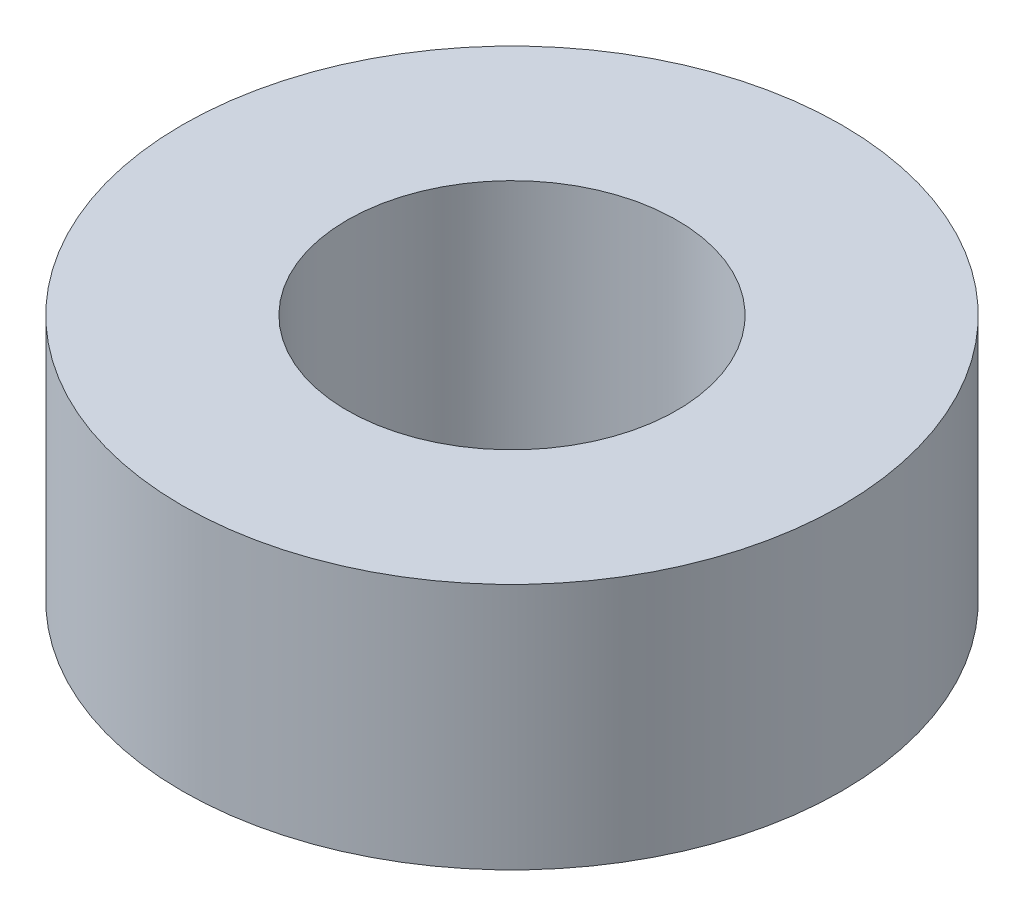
SolidWorks part; units mm, degrees
ref_plane "Front Plane" through (0, 0, 0) normal (0, 0, 1) x (1, 0, 0)
ref_plane "Top Plane" through (0, 0, 0) normal (0, 1, 0) x (1, 0, 0)
ref_plane "Right Plane" through (0, 0, 0) normal (1, 0, 0) x (0, 0, -1)
sketch "Sketch1" plane through (0, 0, 0) normal (0, 0, 1) x (1, 0, 0)
  line L0 (0, 0) -> (-20, 0)
  line L1 (-20, 0) -> (-20, -15)
  line L2 (-20, -15) -> (0, -15)
  line L3 (0, 0) -> (0, -15) construction
  line L4 (-10, 0) -> (-10, -15)
  dimension "D1" = 15
  dimension "D2" = 10
  dimension "D3" = 20
revolve "Revolve1" add sketch "Sketch1" angle 360 about L3
